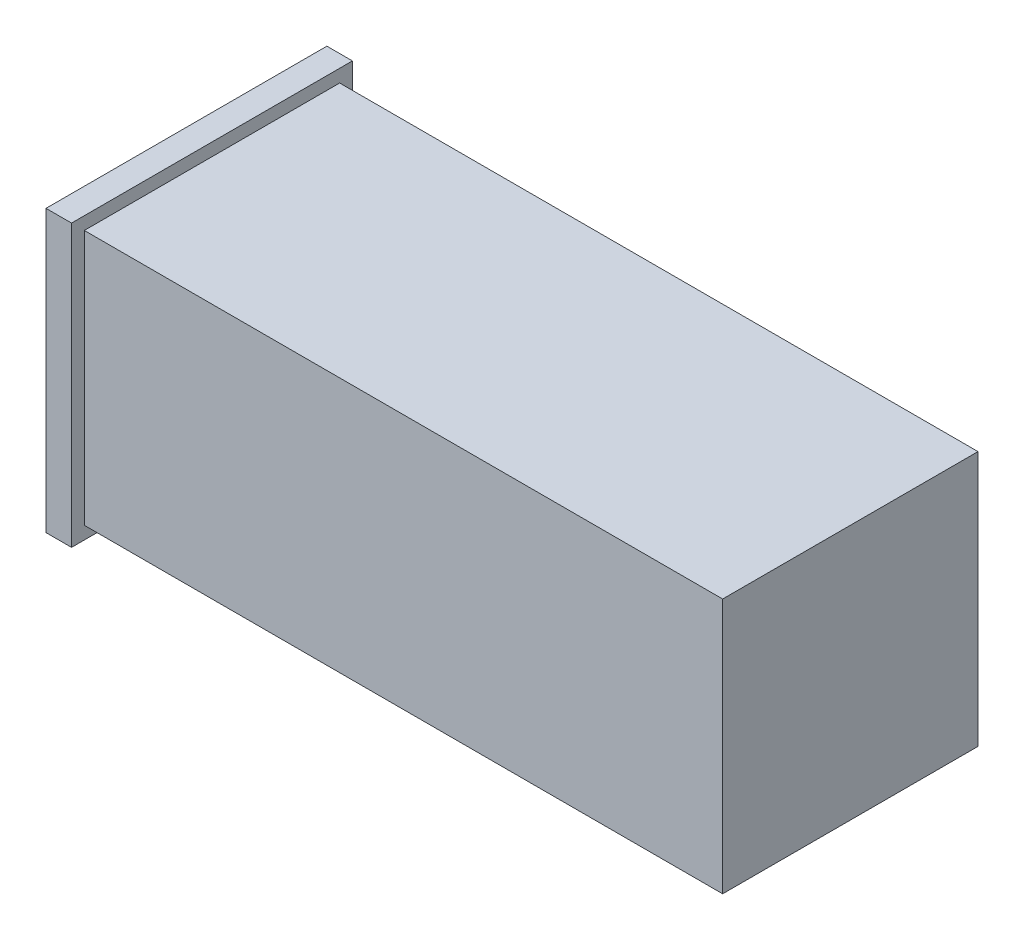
SolidWorks part; units mm, degrees
ref_plane "Front Plane" through (0, 0, 0) normal (0, 0, 1) x (1, 0, 0)
ref_plane "Top Plane" through (0, 0, 0) normal (0, 1, 0) x (1, 0, 0)
ref_plane "Right Plane" through (0, 0, 0) normal (1, 0, 0) x (0, 0, -1)
sketch "Sketch1" plane through (0, 0, 0) normal (0, 0, 1) x (1, 0, 0)
  line L1 (0, -10.9966) -> (250, -10.9966)
  line L2 (0, -10.9966) -> (0, 89.0034)
  line L3 (0, 89.0034) -> (250, 89.0034)
  line L4 (250, -10.9966) -> (250, 89.0034)
  dimension "D1" = 250
  dimension "D2" = 100
extrude "Boss-Extrude1" add sketch "Sketch1" along normal blind 100
sketch "Sketch2" plane through (0, 0, 0) normal (-1, 0, 0) x (0, 0, 1)
  line L5 (100, 89.0034) -> (100, -10.9966) construction
  line L6 (-5, -15.9966) -> (105, -15.9966)
  line L7 (-5, -15.9966) -> (-5, 94.0034)
  line L8 (-5, 94.0034) -> (105, 94.0034)
  line L9 (105, -15.9966) -> (105, 94.0034)
  line L10 (-5, -15.9966) -> (105, 94.0034) construction
  line L11 (-5, 94.0034) -> (105, -15.9966) construction
  line L12 (100, 89.0034) -> (0, 89.0034) construction
  point P0 (50, 39.0034)
  point P7 (100, 39.0034)
  point P8 (105, 39.0034)
  point P11 (50, 89.0034)
  point P12 (50, 94.0034)
  dimension "D1" = 110
  dimension "D2" = 110
extrude "Boss-Extrude2" add sketch "Sketch2" along normal blind 10
